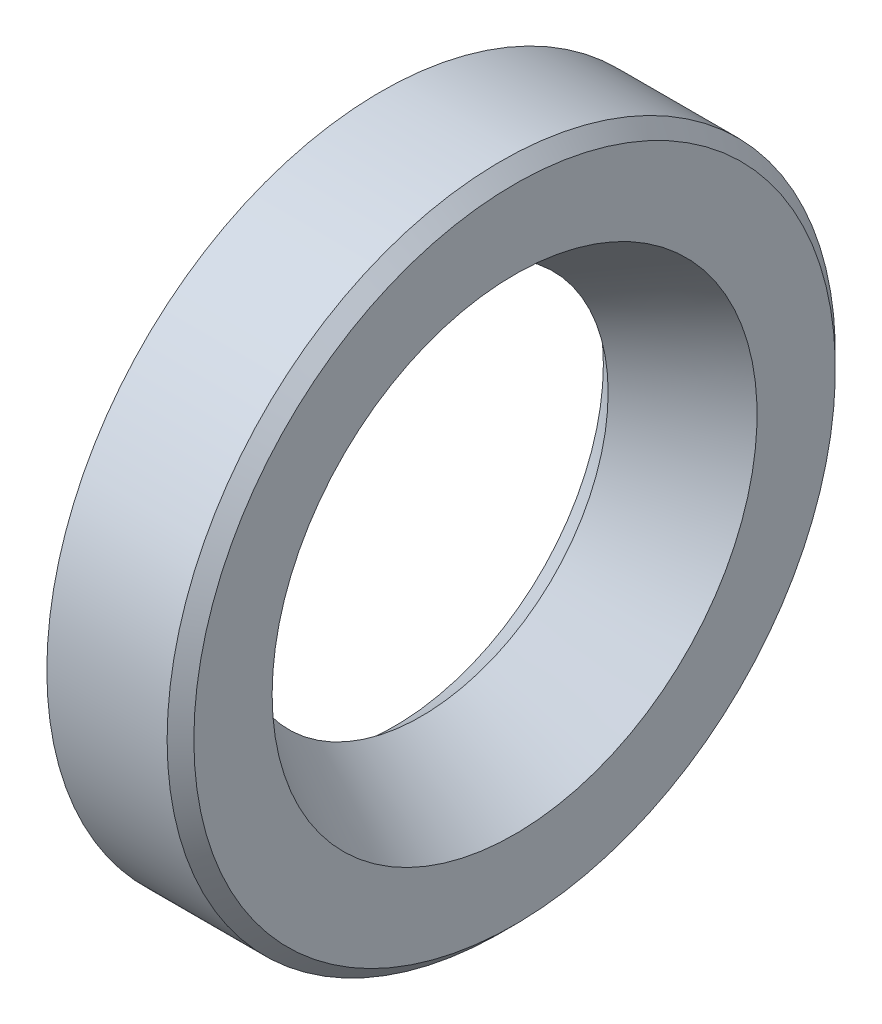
SolidWorks part; units mm, degrees
revolve "Base-Rev" add sketch "Ske" angle 360 about L0
sketch "Ske" plane through (0, 0, 0) normal (0, 0, 1) x (1, 0, 0)
  line L0 (-10, 0) -> (10, 0) construction
  line L1 (2, 18.1429) -> (1, 18.1429)
  line L2 (1, 18.1429) -> (1, 15.6417)
  line L3 (0, 25) -> (9, 25)
  line L4 (10, 18.1429) -> (10, 24)
  line L5 (0, 23.2222) -> (5.6667, 23.2222)
  line L6 (6.6667, 22.2222) -> (6.6667, 18.1429)
  line L7 (5.6667, 17.1429) -> (3, 17.1429)
  line L8 (0, 23.2222) -> (0, 25)
  line L9 (1, 15.6417) -> (3, 14)
  line L10 (3, 14) -> (10, 18.1429)
  line L12 (9, 25) -> (10, 24)
  arc A0 (6.6667, 22.2222) -> (5.6667, 23.2222) centre (5.6667, 22.2222) ccw
  arc A1 (6.6667, 18.1429) -> (5.6667, 17.1429) centre (5.6667, 18.1429) cw
  arc A2 (3, 17.1429) -> (2, 18.1429) centre (3, 18.1429) ccw
  point P1 (10, 25)
ref_plane "Спереди" through (0, 0, 0) normal (0, 0, 1) x (1, 0, 0)
ref_plane "Сверху" through (0, 0, 0) normal (0, 1, 0) x (1, 0, 0)
ref_plane "Справа" through (0, 0, 0) normal (1, 0, 0) x (0, 0, -1)
sketch "Ske2" plane through (0, 0, 0) normal (0, 0, 1) x (1, 0, 0)
  line L0 (10, 18.1429) -> (14, 15.0365)
  line L2 (8.5508, 18.1429) -> (13.8854, 14)
  line L3 (10, 18.1429) -> (8.5508, 18.1429)
  line L4 (13.8854, 14) -> (14, 14.1476)
  line L6 (-1.3061, 0) -> (10, 0) construction
  line L9 (14, 15.0365) -> (14, 14.1476)
  line L10 (1, 18.1429) -> (1, 15.6417) construction
  line L11 (0, 25) -> (0, -25) construction
revolve "Rev1" [suppressed] add sketch "Ske2" angle 360 about L6
equation "\"D4@Ske\" = \"D3@Ske\"/3"
equation "\"D7@Ske\" = \"D3@Ske\"/10"
equation "\"D8@Ske\" = \"D3@Ske\"/10"
equation "\"D10@Ske\" = \"D7@Ske\"*2"
equation "\"D6@Ske\"=(\"D2@Ske\"-\"D11@Ske\")/7"
equation "\"D1@Ske\" = \"D7@Ske\""
equation "\"D1@Ske2\"=\"D5@Ske\"*.5"
equation "\"D3@Ske2\"=\"D1@Ske2\""
